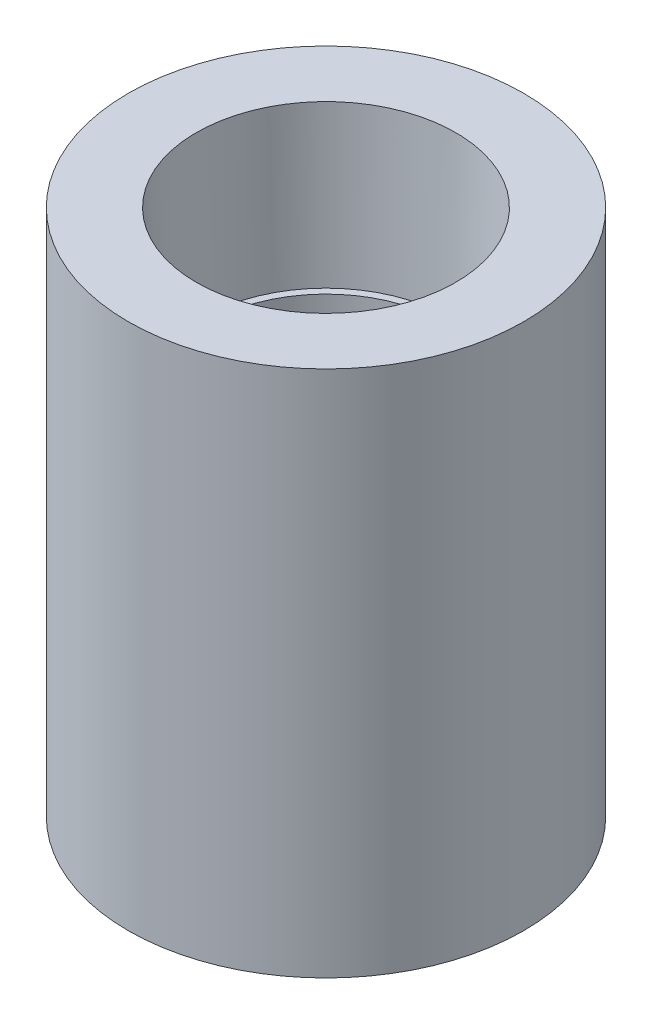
SolidWorks part; units mm, degrees
ref_plane "Přední rovina" through (0, 0, 0) normal (0, 0, 1) x (1, 0, 0)
ref_plane "Horní rovina" through (0, 0, 0) normal (0, 1, 0) x (1, 0, 0)
ref_plane "Pravá rovina" through (0, 0, 0) normal (1, 0, 0) x (0, 0, -1)
sketch "Skica1" plane through (0, 0, 0) normal (0, 1, 0) x (1, 0, 0)
  circle A0 centre (0, 0) radius 15
  dimension "D1" = 30
extrude "Přidat vysunutím1" add sketch "Skica1" along normal blind 40
hole_wizard "1/2 sérii závitu1" positions "Skica3" profile "Skica2" size "1/2" standard "ANSI palce"
sketch "Skica3" plane through (0, 40, 0) normal (0, 1, 0) x (-1, 0, 0)
  circle A0 centre (0, 0) radius 15 construction
  point P0 (0, 0)
  dimension "D1" = 0
sketch "Skica2" plane through (0, 40, 0) normal (1, 0, 0) x (0, 0, 1)
  line L0 (0, 0) -> (0, 25.1546)
  line L1 (8.9281, 20) -> (0, 25.1546)
  line L2 (-8.9281, 20) -> (0, 25.1546) construction
  line L3 (8.9281, 20) -> (8.9281, 12)
  line L4 (8.9281, 12) -> (9.4797, 12)
  line L5 (9.4797, 12) -> (9.839, 0)
  line L6 (-9.4797, 12) -> (-9.839, 0) construction
  line L7 (9.839, 0) -> (0, 0)
  line L8 (0, -6.35) -> (0, 107.95) construction
  line L11 (-8.9281, 12) -> (-9.4797, 12) construction
  dimension "Průměr závitníku" = 17.8562
  dimension "Hloubka závitníku" = 20
  dimension "Průměr závitu" = 19.678
  dimension "Úhel závitu" = 3.43
  dimension "Hloubka závitu" = 12
  dimension "Úhel vrtání" = 120
